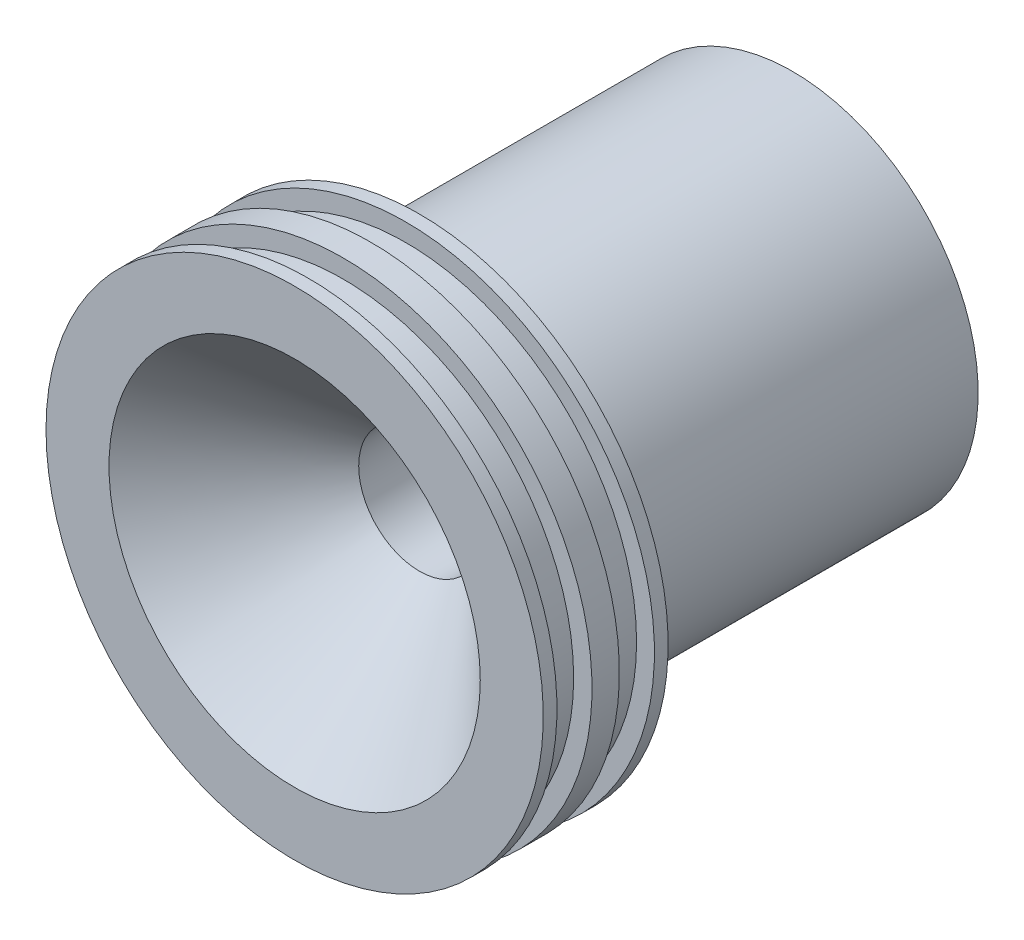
SolidWorks part; units mm, degrees
ref_plane "Front Plane" through (0, 0, 0) normal (1, 0, 0) x (0, 1, 0)
ref_plane "Top Plane" through (0, 0, 0) normal (0, 0, 1) x (0, 1, 0)
ref_plane "Right Plane" through (0, 0, 0) normal (0, 1, 0) x (-1, 0, 0)
sketch "Sketch1" plane through (0, 0, 0) normal (1, 0, 0) x (0, 1, 0)
  line L0 (9.2535, 7.2669) -> (28.2575, 26.271)
  line L1 (0, -87.4649) -> (0, 25.89) construction
  line L2 (9.2535, 7.2669) -> (9.2535, -7.2669)
  line L3 (0, 25.89) -> (28.2575, 25.89) construction
  line L4 (9.2535, 40.227) -> (9.2535, -25.6932) construction
  line L5 (9.2535, -7.2669) -> (20.574, -49.5157)
  line L6 (20.574, -49.5157) -> (28.2575, -49.5157)
  line L7 (28.2575, -49.5157) -> (28.2575, 7.2669)
  line L8 (28.2575, 7.2669) -> (37.846, 7.2669)
  line L12 (37.846, 26.271) -> (28.2575, 26.271)
  line L13 (0.2515, 7.2669) -> (37.846, 7.2669) construction
  line L14 (37.846, 16.769) -> (37.846, 14.6849)
  line L15 (37.846, 14.6849) -> (35.1282, 14.6849)
  line L16 (35.1282, 14.6849) -> (35.1282, 9.3509)
  line L17 (35.1282, 9.3509) -> (37.846, 9.3509)
  line L18 (37.846, 9.3509) -> (37.846, 7.2669)
  line L19 (37.846, 9.3509) -> (37.846, 14.6849) construction
  line L20 (37.846, 26.271) -> (37.846, 24.187)
  line L21 (37.846, 24.187) -> (35.052, 24.187)
  line L22 (35.052, 24.187) -> (35.052, 18.853)
  line L23 (35.052, 18.853) -> (37.846, 18.853)
  line L24 (37.846, 18.853) -> (37.846, 16.769)
  line L25 (28.2575, 26.271) -> (28.2575, 7.2669) construction
  line L26 (37.846, 16.769) -> (37.846, 26.271) construction
  point P3 (9.2535, 7.2669)
  point P17 (37.846, 12.0179)
  point P18 (37.846, 21.52)
  point P23 (35.1282, 12.0179)
  point P24 (35.052, 21.52)
  point P30 (9.2535, 0)
revolve "Revolve1" add sketch "Sketch1" angle 360 about L1
ref_plane "Plane1" through (37.592, 0, 0) normal (1, 0, 0) x (0, 1, 0)
equation "\"TL\"=0.5722"
equation "\"D9@Sketch1\"=\"TL\""
equation "\"NR\"= \"TL\""
